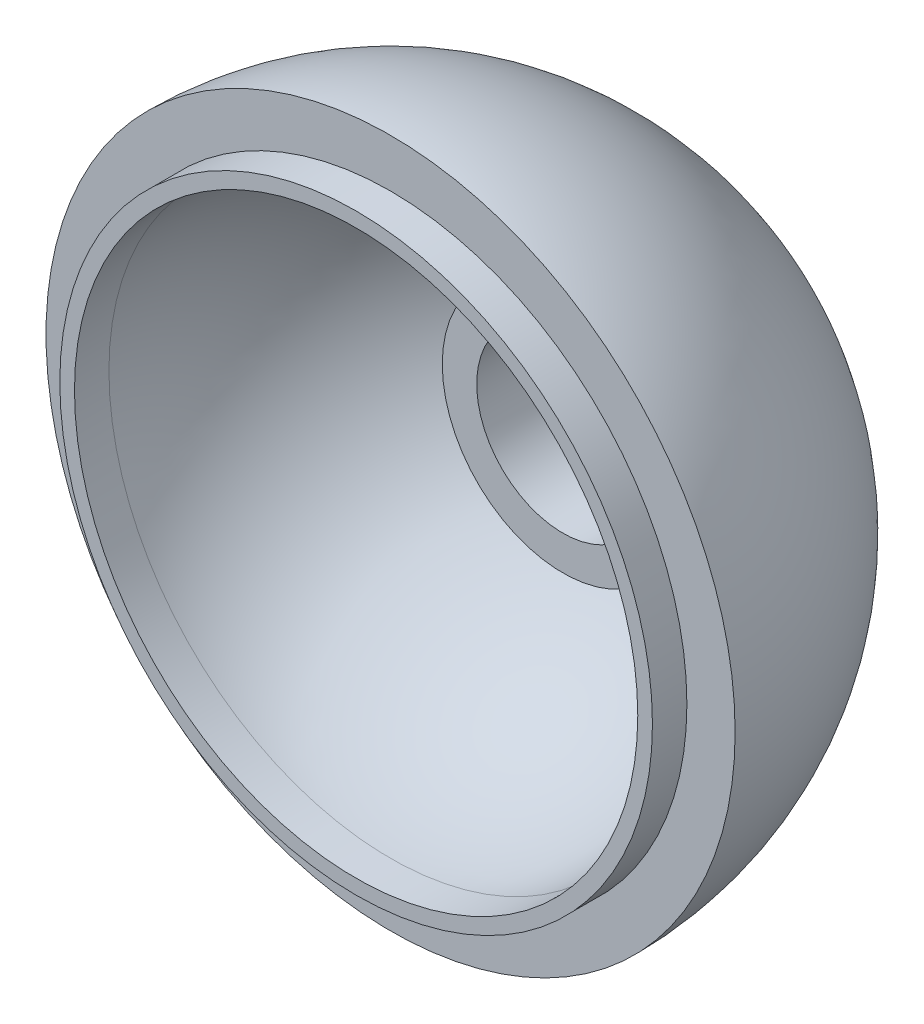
SolidWorks part; units mm, degrees
ref_plane "Plan de face" through (0, 0, 0) normal (0, 0, 1) x (1, 0, 0)
ref_plane "Plan de dessus" through (0, 0, 0) normal (0, 1, 0) x (1, 0, 0)
ref_plane "Plan de droite" through (0, 0, 0) normal (1, 0, 0) x (0, 0, -1)
sketch "Esquisse1" plane through (0, 0, 0) normal (0, 1, 0) x (1, 0, 0)
  line L0 (-10, 0) -> (-8.6, 0)
  line L1 (0, 0) -> (0, 10) construction
  line L2 (0, 0) -> (-10, 0) construction
  line L3 (-8.6, 0) -> (-8.6, -1)
  line L4 (-8.6, -1) -> (-8.1745, -1)
  line L5 (-8.1745, -1) -> (-8.1745, 0)
  line L6 (-2.5, 7.7828) -> (-2.5, 5)
  line L7 (-2.5, 5) -> (-3.5, 5)
  line L8 (-3.5, 5) -> (-3.5, 7.3873)
  line L9 (0, 10) -> (0, 8.1745)
  arc A0 (0, 10) -> (-10, 0) centre (0, 0) ccw
  arc A1 (0, 8.1745) -> (-2.5, 7.7828) centre (0, 0) ccw
  arc A2 (-3.5, 7.3873) -> (-8.1745, 0) centre (0, 0) ccw
  arc A3 (0, 8.1745) -> (-8.1745, 0) centre (0, 0) ccw construction
  dimension "D1" = 20
  dimension "D2" = 1
  dimension "D3" = 8.6
  dimension "D4" = 5
  dimension "D5" = 3.5
  dimension "D6" = 2.5
revolve "Révolution1" add sketch "Esquisse1" angle 360 about L1
